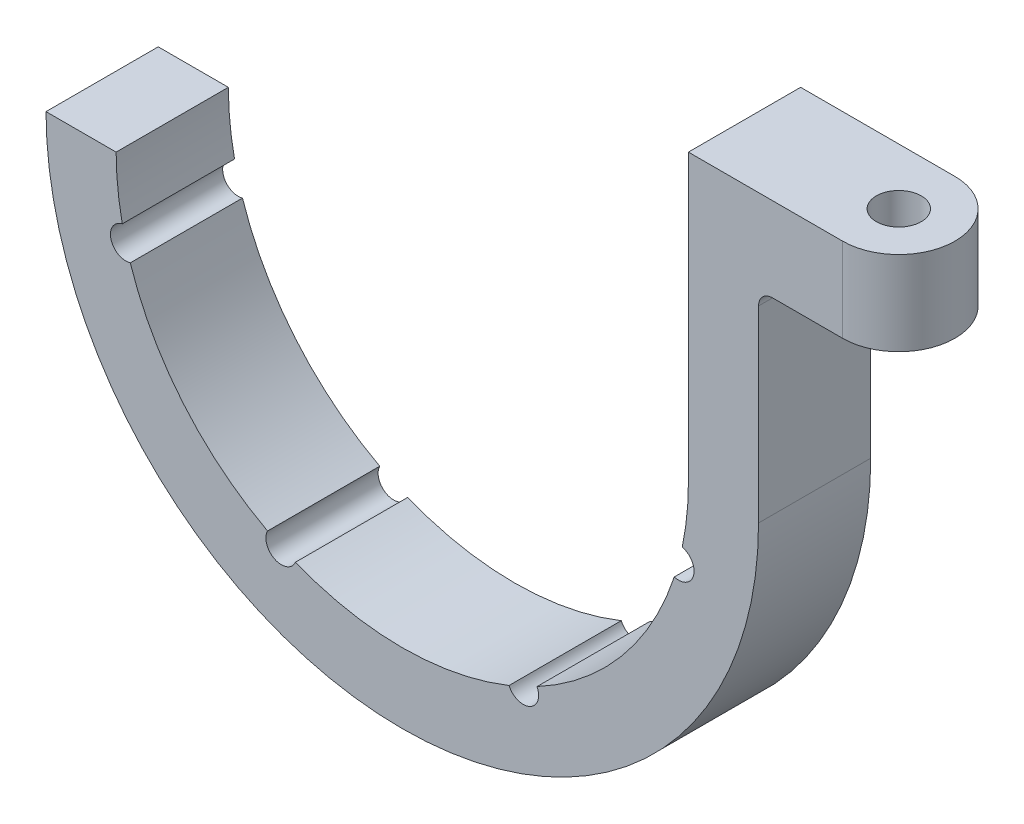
SolidWorks part; units mm, degrees
ref_plane "Front Plane" through (0, 0, 0) normal (0, 0, 1) x (1, 0, 0)
ref_plane "Top Plane" through (0, 0, 0) normal (0, 1, 0) x (1, 0, 0)
ref_plane "Right Plane" through (0, 0, 0) normal (1, 0, 0) x (0, 0, -1)
sketch "Sketch1" plane through (0, 0, 0) normal (0, 0, 1) x (1, 0, 0)
  line L0 (0, 41.3275) -> (0, -40.7068) construction
  line L1 (-59.5671, -15.961) -> (0, 0) construction
  line L2 (-25.915, -55.5749) -> (0, 0) construction
  line L3 (-20.4, 0) -> (-25.4, 0)
  line L8 (20.4, 0) -> (20.4, 20.4)
  line L9 (20.4, 20.4) -> (25.4, 20.4)
  line L10 (25.4, 0) -> (25.4, 20.4)
  circle A0 centre (0, 0) radius 20.4
  circle A1 centre (0, 0) radius 25.4
  circle A2 centre (-19.7049, -5.2799) radius 1.1
  circle A3 centre (-8.6214, -18.4887) radius 1.1
  circle A4 centre (8.6214, -18.4887) radius 1.1
  circle A5 centre (19.7049, -5.2799) radius 1.1
  dimension "D1" = 5
  dimension "D2" = 40.8
  dimension "D5" = 2.2
  dimension "D6" = 2.2
  dimension "D3" = 50
  dimension "D4" = 25
extrude "Boss-Extrude1" add sketch "Sketch1" along normal blind 8
sketch "Sketch2" plane through (0, 20.4, 0) normal (0, 1, 0) x (1, 0, 0)
  line L0 (25.4, -8) -> (25.4, 0)
  line L1 (25.4, 0) -> (31.4, 0)
  line L2 (31.4, -8) -> (25.4, -8)
  arc A0 (31.4, 0) -> (31.4, -8) centre (31.4, -4) cw
  circle A1 centre (31.4, -4) radius 1.6
  dimension "D1" = 3.2
  dimension "D2" = 6
extrude "Boss-Extrude2" add sketch "Sketch2" against normal blind 6
fillet "Fillet1" radius 1 1 edges at (25.4, 14.4, 4)
